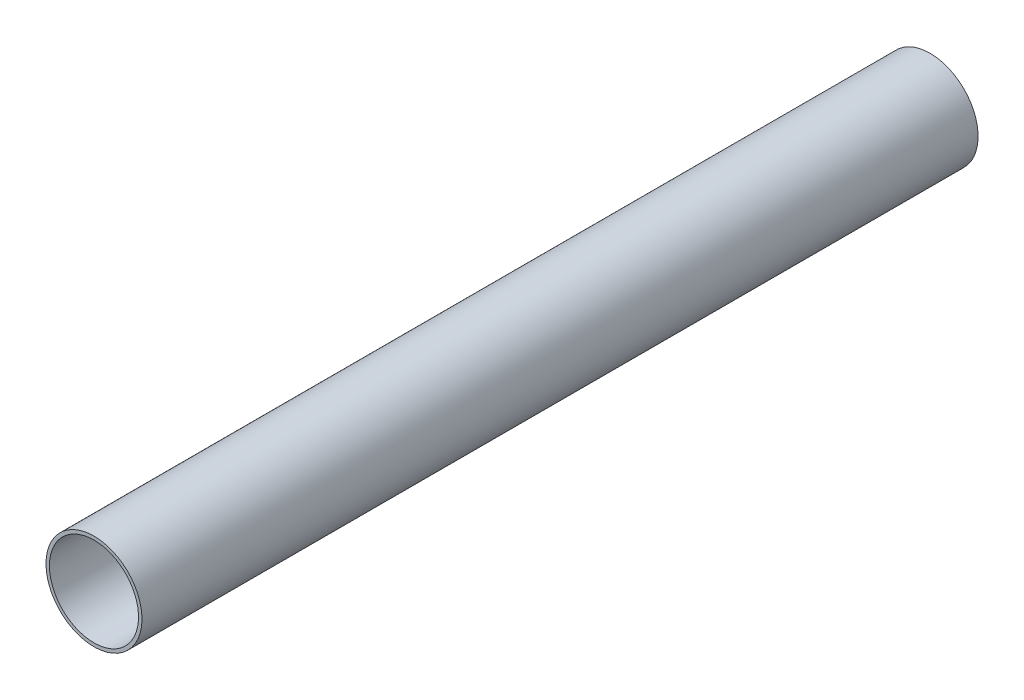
SolidWorks part; units mm, degrees
ref_plane "Face" through (0, 0, 0) normal (0, 0, 1) x (1, 0, 0)
ref_plane "Dessus" through (0, 0, 0) normal (0, 1, 0) x (1, 0, 0)
ref_plane "Droite" through (0, 0, 0) normal (1, 0, 0) x (0, 0, -1)
sketch "Esquisse1" plane through (0, 0, 0) normal (0, 0, 1) x (1, 0, 0)
  circle A0 centre (0, -2.1236) radius 13
  dimension "D1" = 26
extrude "Extru.-Mince1" add sketch "Esquisse1" along normal blind 244 thin
